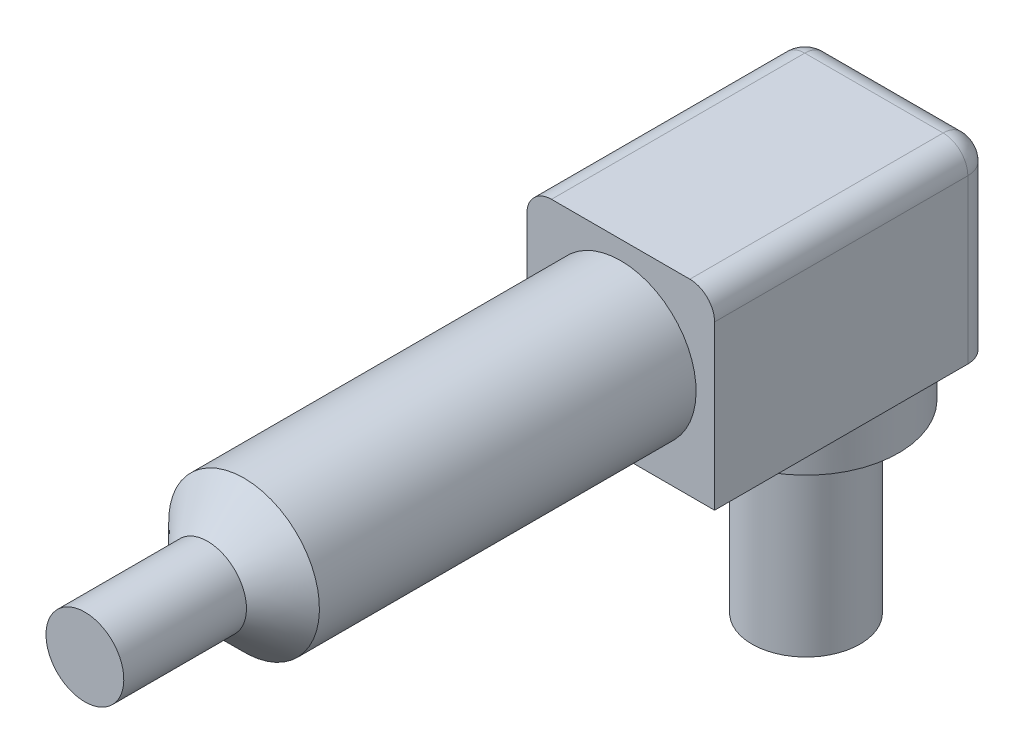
SolidWorks part; units mm, degrees
ref_plane "Front Plane" through (0, 0, 0) normal (0, 0, 1) x (1, 0, 0)
ref_plane "Top Plane" through (0, 0, 0) normal (0, 1, 0) x (1, 0, 0)
ref_plane "Right Plane" through (0, 0, 0) normal (1, 0, 0) x (0, 0, -1)
sketch "Sketch2" plane through (0, 0, 0) normal (0, 0, 1) x (1, 0, 0)
  line L1 (-9.652, -9.652) -> (9.652, -9.652)
  line L2 (-9.652, -9.652) -> (-9.652, 9.652)
  line L3 (-9.652, 9.652) -> (9.652, 9.652)
  line L4 (9.652, -9.652) -> (9.652, 9.652)
  line L5 (-9.652, -9.652) -> (9.652, 9.652) construction
  line L6 (-9.652, 9.652) -> (9.652, -9.652) construction
  point P0 (0, 0)
  dimension "D1" = 19.304
  dimension "D2" = 19.304
extrude "Boss-Extrude1" add sketch "Sketch2" along normal blind 28.575
sketch "Sketch3" plane through (0, 0, 0) normal (1, 0, 0) x (0, 0, -1)
  line L0 (-9.525, -9.652) -> (-9.525, -36.1948) construction
  line L1 (-28.575, -9.652) -> (0, -9.652) construction
  line L2 (-9.525, -9.652) -> (0, -9.652)
  line L3 (0, -9.652) -> (0, -14.148)
  line L4 (0, -14.148) -> (-3.9688, -14.148)
  line L5 (-3.9688, -14.148) -> (-3.9687, -33.148)
  line L6 (-3.9687, -33.148) -> (-9.525, -33.148)
  line L7 (-9.525, -33.148) -> (-9.525, -9.652)
  line L8 (-28.575, 9.652) -> (0, 9.652) construction
  dimension "D1" = 11.1125
  dimension "D2" = 19.05
  dimension "D3" = 23.8
  dimension "D4" = 19
revolve "Revolve1" add sketch "Sketch3" angle 360 about L0
sketch "Sketch4" plane through (0, 0, 0) normal (1, 0, 0) x (0, 0, -1)
  line L0 (0, 0) -> (-94.7513, 0) construction
  line L1 (-28.575, 7.75) -> (-42.3, 7.75)
  line L2 (-28.575, -9.652) -> (-28.575, 9.652) construction
  line L3 (-42.3, 7.75) -> (-67.3, 7.75)
  line L4 (-67.3, 7.75) -> (-71.05, 4)
  line L5 (-71.05, 4) -> (-83.6612, 4)
  line L6 (-83.6612, 4) -> (-83.6612, 0)
  line L7 (-83.6612, 0) -> (-28.575, 0)
  line L8 (-28.575, 0) -> (-28.575, 7.75)
  line L9 (0, -9.652) -> (0, 9.652) construction
  dimension "D1" = 42.3
  dimension "D2" = 25
  dimension "D3" = 45
  dimension "D4" = 8
  dimension "D5" = 15.5
revolve "Revolve2" add sketch "Sketch4" angle 360 about L0
sketch "Sketch5" plane through (0, 0, 0) normal (1, 0, 0) x (0, 0, -1)
  line L0 (-83.6612, 0) -> (0, 0) construction
  line L1 (-83.6612, 4) -> (-83.6612, -4) construction
fillet "Fillet1" radius 2.54 5 edges at (-9.652, 9.652, 14.2875) (-9.652, 0, 0) (0, 9.652, 0) (9.652, 0, 0) (9.652, 9.652, 14.2875)
